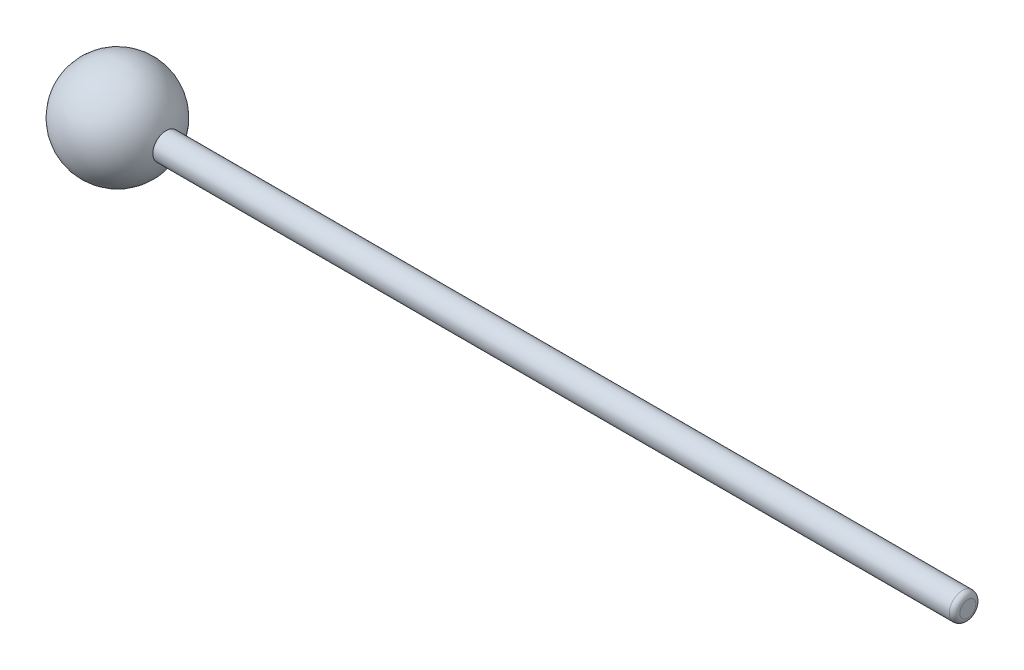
SolidWorks part; units mm, degrees
ref_plane "Front Plane" through (0, 0, 0) normal (0, 0, 1) x (1, 0, 0)
ref_plane "Top Plane" through (0, 0, 0) normal (0, 1, 0) x (1, 0, 0)
ref_plane "Right Plane" through (0, 0, 0) normal (1, 0, 0) x (0, 0, -1)
sketch "Sketch2" plane through (0, 0, 0) normal (0, 0, 1) x (1, 0, 0)
  line L0 (0, 0) -> (-9.5, 0)
  line L2 (0, 0) -> (0, 2.5)
  line L3 (0, 2.5) -> (9.1652, 2.5)
  arc A0 (9.1652, 2.5) -> (-9.5, 0) centre (0, 0) ccw
  point P5 (0, 0)
  dimension "D1" = 2.5
  dimension "D2" = 9.5
revolve "Revolve1" add sketch "Sketch2" angle 360 about L0
sketch "Sketch3" plane through (0, 0, 0) normal (1, 0, 0) x (0, 0, -1)
  circle A1 centre (0, 0) radius 2.5
  circle A2 centre (0, 0) radius 2.5
  dimension "D1" = 0
extrude "Boss-Extrude1" add sketch "Sketch3" along normal blind 160 separate body
fillet "Fillet1" radius 1 1 edges at (160, 0, -2.5)
